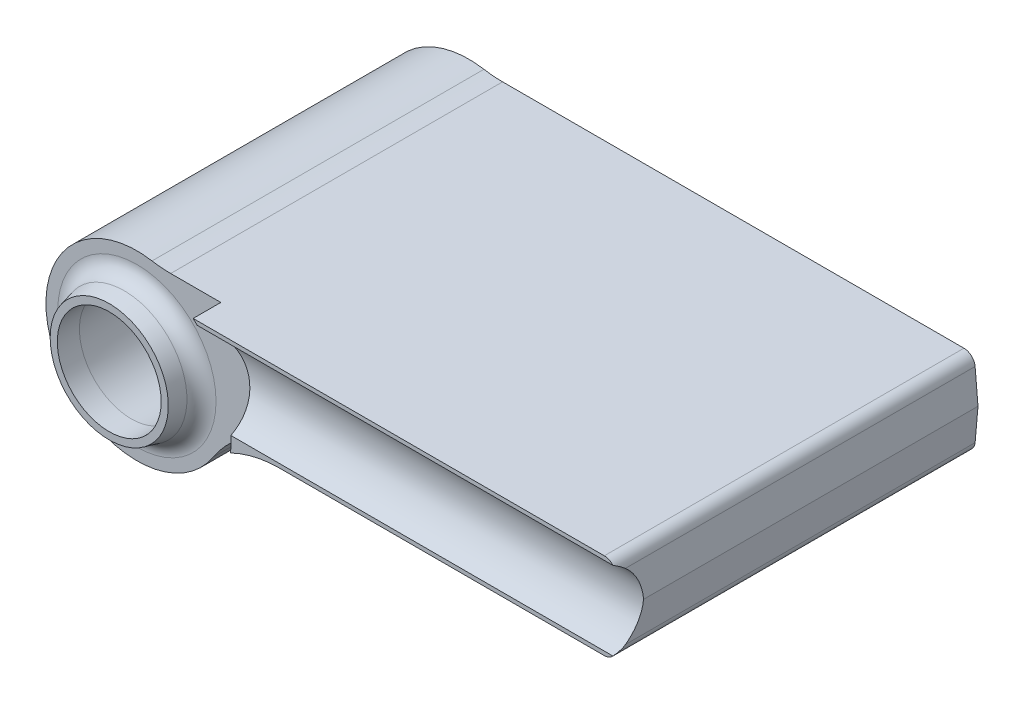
SolidWorks part; units mm, degrees
ref_plane "Plan1" through (0, 0, 0) normal (0, 0, 1) x (1, 0, 0)
ref_plane "Plan2" through (0, 0, 0) normal (0, 1, 0) x (1, 0, 0)
ref_plane "Plan3" through (0, 0, 0) normal (1, 0, 0) x (0, 0, -1)
sketch "Esquisse1" plane through (0, 0, 0) normal (0, 0, 1) x (1, 0, 0)
  line L0 (-20, 0) -> (30, 0) construction
  line L1 (-20, 8.12) -> (103.692, 8.12) construction
  line L2 (6.1008, 15.935) -> (89.4898, 15.935)
  line L3 (91.5121, 14.0819) -> (92.0337, 8.12)
  line L4 (91.5121, 2.1581) -> (92.0337, 8.12)
  line L5 (30.8285, 0.305) -> (89.4898, 0.305)
  arc A0 (2.7304, 16.2168) -> (13.7971, -8.9486) centre (0, 0) ccw
  arc A1 (89.4898, 15.935) -> (91.5121, 14.0819) centre (89.4898, 13.905) cw
  arc A2 (89.4898, 0.305) -> (91.5121, 2.1581) centre (89.4898, 2.335) ccw
  arc A3 (30.8285, 0.305) -> (13.7971, -8.9486) centre (30.8285, -19.995) ccw
  arc A4 (2.7304, 16.2168) -> (6.1008, 15.935) centre (6.1008, 36.235) ccw
  point P4 (0, 0)
  point P12 (91.35, 15.935)
  dimension "D1" = 32.89
  dimension "D6" = 2.03
  dimension "D7" = 20.3
  dimension "D8" = 20.3
  dimension "D2" = 8.12
  dimension "D3" = 7.815
  dimension "D4" = 85
  dimension "D5" = 91.35
extrude "Base-Extrusion" add sketch "Esquisse1" along normal blind 65
sketch "Esquisse14"
extrude "Enlèv. mat.-Extru.4" [suppressed] cut sketch "Esquisse14" against normal blind 2
sketch "Esquisse3" plane through (0, 0, 0) normal (0, 1, 0) x (1, 0, 0)
  line L0 (0, 7.8237) -> (0, -74.996) construction
  line L1 (0, -65) -> (0, 0) construction
  line L2 (10.68, -65) -> (11.352, -62.3046)
  line L3 (-16.445, -65) -> (13.7971, -65) construction
  line L4 (14.3017, -60) -> (22, -60)
  line L5 (22, -60) -> (22, -65)
  line L6 (30.8285, -65) -> (89.4898, -65) construction
  line L7 (22, -65) -> (10.68, -65)
  arc A0 (14.3017, -60) -> (11.352, -62.3046) centre (14.3017, -63.04) ccw
  dimension "D5" = 3.04
  dimension "D1" = 14
  dimension "D2" = 5
  dimension "D3" = 21.36
  dimension "D4" = 22
revolve "Enlèvement de matière-Révolution2" cut sketch "Esquisse3" angle 360 about L0
ref_plane "Plan4" through (95, 0, 0) normal (1, 0, 0) x (0, 0, -1)
sketch "Esquisse4" plane through (95, 0, 0) normal (1, 0, 0) x (0, 0, -1)
  line L1 (-68.27, 26.2142) -> (-68.27, -28.3196) construction
  line L2 (-65, 2.1581) -> (-65, 8.12) construction
  line L3 (-84.4515, 8.12) -> (-48.1681, 8.12) construction
  line L4 (-65, 8.12) -> (0, 8.12) construction
  circle A0 centre (-68.27, 8.12) radius 7.815
  dimension "D2" = 15.63
  dimension "D1" = 3.27
extrude "Enlèv. mat.-Extru.1" cut sketch "Esquisse4" against normal up to next
sketch "Esquisse5" plane through (0, 0, 65) normal (0, 0, 1) x (1, 0, 0)
  circle A0 centre (0, 0) radius 9.39
  dimension "D1" = 18.78
extrude "Enlèv. mat.-Extru.2" cut sketch "Esquisse5" against normal blind 4
sketch "Esquisse6" plane through (0, 0, 61) normal (0, 0, 1) x (1, 0, 0)
  circle A1 centre (0, 0) radius 9.39
  circle A2 centre (0, 0) radius 9.39
  dimension "D1" = 0
extrude "Enlèv. mat.-Extru.3" cut sketch "Esquisse6" against normal through all draft 3
hole_wizard "Perçage1" positions "Esquisse11" profile "Esquisse10" hole size "M10" standard "ISO"
sketch "Esquisse11" plane through (0, 0, 0) normal (0, 0, -1) x (-1, 0, 0)
  line L0 (-92.0337, 8.12) -> (-20.8231, 8.12) construction
  line L1 (32.1503, 8.12) -> (-14.9626, 8.12) construction
  point P0 (-30, 8.12)
  dimension "D1" = 30
sketch "Esquisse10" plane through (30, 8.12, 0) normal (1, 0, 0) x (0, 1, 0)
  line L0 (0, 0) -> (0, 50.4537)
  line L1 (0, 50.4537) -> (4.25, 48)
  line L2 (4.25, 48) -> (4.25, 0)
  line L5 (4.25, 0) -> (0, 0)
  line L10 (0, 50.4537) -> (-4.25, 48) construction
  line L11 (0, -6.35) -> (0, 107.95) construction
  dimension "Diamètre du perçage" = 8.5
  dimension "Profondeur du perçage" = 48
  dimension "Angle de pointe" = 120
hole_wizard "Perçage2" positions "Esquisse13" profile "Esquisse12" hole size "M10" standard "ISO"
sketch "Esquisse13" plane through (0, 0, 0) normal (0, 0, -1) x (-1, 0, 0)
  line L0 (-94.139, 8.12) -> (-44.9902, 8.12) construction
  line L1 (32.1503, 8.12) -> (-14.9626, 8.12) construction
  point P0 (-75, 8.12)
  dimension "D1" = 45
sketch "Esquisse12" plane through (75, 8.12, 0) normal (1, 0, 0) x (0, 1, 0)
  line L0 (0, 0) -> (0, 50.4537)
  line L1 (0, 50.4537) -> (4.25, 48)
  line L2 (4.25, 48) -> (4.25, 0)
  line L5 (4.25, 0) -> (0, 0)
  line L10 (0, 50.4537) -> (-4.25, 48) construction
  line L11 (0, -6.35) -> (0, 107.95) construction
  dimension "Diamètre du perçage" = 8.5
  dimension "Profondeur du perçage" = 48
  dimension "Angle de pointe" = 120
